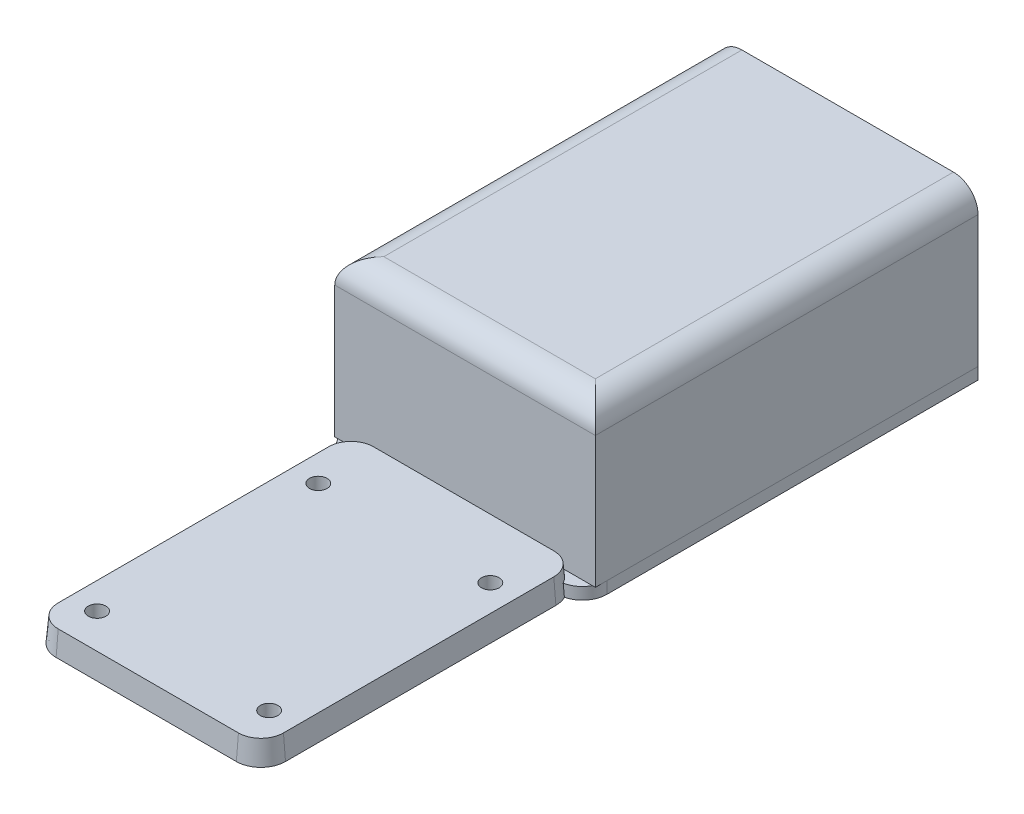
SolidWorks part; units mm, degrees
ref_plane "Front Plane" through (0, 0, 0) normal (0, 0, 1) x (1, 0, 0)
ref_plane "Top Plane" through (0, 0, 0) normal (0, 1, 0) x (1, 0, 0)
ref_plane "Right Plane" through (0, 0, 0) normal (1, 0, 0) x (0, 0, -1)
sketch "Sketch1" plane through (0, 0, 0) normal (0, 1, 0) x (1, 0, 0)
  line L1 (22, -39) -> (-22, -39)
  line L2 (28, -33) -> (28, 33)
  line L3 (22, 39) -> (-22, 39)
  line L4 (-28, -33) -> (-28, 33)
  line L5 (28, -39) -> (-28, 39) construction
  line L6 (28, 39) -> (-28, -39) construction
  arc A0 (-28, -33) -> (-22, -39) centre (-22, -33) ccw
  arc A1 (22, -39) -> (28, -33) centre (22, -33) ccw
  arc A2 (28, 33) -> (22, 39) centre (22, 33) ccw
  arc A3 (-22, 39) -> (-28, 33) centre (-22, 33) ccw
  point P0 (0, 0)
  dimension "D3" = 6
  dimension "D1" = 56
  dimension "D2" = 78
extrude "Boss-Extrude1" add sketch "Sketch1" along normal blind 5.8 draft 5
hole_wizard "Ø4.3 (4.3) Diameter Hole1" positions "Sketch4" profile "Sketch3" hole size "Ø4.3" standard "ANSI Metric"
sketch "Sketch4" plane through (0, 5.8, 0) normal (0, 1, 0) x (1, 0, 0)
  line L0 (0, 0) -> (0, -3) construction
  line L3 (21, -30) -> (-21, -30)
  line L4 (21, -30) -> (21, 24)
  line L5 (21, 24) -> (-21, 24)
  line L6 (-21, -30) -> (-21, 24)
  line L7 (21, -30) -> (-21, 24) construction
  line L8 (21, 24) -> (-21, -30) construction
  point P7 (-21, 24)
  point P208 (21, -30)
  point P209 (21, 24)
  point P210 (-21, -30)
  dimension "D1" = 3
  dimension "D2" = 42
  dimension "D3" = 54
sketch "Sketch3" plane through (-21, 5.8, -24) normal (1, 0, 0) x (0, 0, 1)
  line L0 (0, 0) -> (0, 5.8)
  line L1 (0, 5.8) -> (2.15, 5.8)
  line L2 (2.15, 5.8) -> (2.15, 0)
  line L5 (2.15, 0) -> (0, 0)
  line L11 (0, -6.35) -> (0, 107.95) construction
  dimension "Thru Hole Dia." = 4.3
  dimension "Thru Hole Depth" = 5.8
sketch "Sketch6" plane through (0, 0, 0) normal (0, -1, 0) x (-1, 0, 0)
  line L0 (31.6747, 41.5876) -> (31.6747, 132.1554)
  line L1 (25.6747, 35.5876) -> (-25.8878, 35.5876)
  line L2 (31.6747, 132.1554) -> (-31.8878, 132.1554)
  line L3 (-31.8878, 41.5876) -> (-31.8878, 132.1554)
  line L4 (31.6747, 35.5876) -> (-31.8878, 132.1554) construction
  line L5 (31.6747, 132.1554) -> (-31.8878, 35.5876) construction
  arc A0 (-31.8878, 41.5876) -> (-25.8878, 35.5876) centre (-25.8878, 41.5876) ccw
  arc A1 (31.6747, 41.5876) -> (25.6747, 35.5876) centre (25.6747, 41.5876) cw
  point P1 (-0.1065, 83.8715)
  dimension "D3" = 6
  dimension "D1" = 63.5625
  dimension "D2" = 96.5679
extrude "Boss-Extrude2" add sketch "Sketch6" against normal blind 2.9
hole_wizard "Ø4.3 (4.3) Diameter Hole2" positions "3DSketch1" profile "Sketch8" hole size "Ø4.3" standard "ANSI Metric"
sketch3d "3DSketch1"
  line L0 (-21, 0, -24) -> (-21, 5.8, -24) construction
  line L1 (21, 0, -24) -> (21, 5.8, -24) construction
  line L2 (21, 0, 30) -> (21, 5.8, 30) construction
  line L3 (-21, 0, 30) -> (-21, 5.8, 30) construction
  point P0 (-21, 5.8, -24)
  point P5 (-21, 5.8, -24)
  point P7 (21, 5.8, -24)
  point P11 (21, 5.8, 30)
  point P15 (-21, 5.8, 30)
sketch "Sketch8" plane through (-21, 5.8, -24) normal (1, 0, 0) x (0, 0, 1)
  line L0 (0, 0) -> (0, 5.8)
  line L1 (0, 5.8) -> (2.15, 5.8)
  line L2 (2.15, 5.8) -> (2.15, 0)
  line L5 (2.15, 0) -> (0, 0)
  line L11 (0, -6.35) -> (0, 107.95) construction
  dimension "Thru Hole Dia." = 4.3
  dimension "Thru Hole Depth" = 5.8
sketch "Sketch18" plane through (0, 2.9, 0) normal (0, 1, 0) x (1, 0, 0)
  line L1 (31.8956, 38.7463) -> (-31.7287, 38.7463)
  line L2 (31.8956, 38.7463) -> (31.8956, 132.15)
  line L3 (31.8956, 132.15) -> (-31.7287, 132.15)
  line L4 (-31.7287, 38.7463) -> (-31.7287, 132.15)
extrude "Boss-Extrude4" add sketch "Sketch18" along normal blind 38.1
sketch "Sketch19" plane through (0, 0, -132.15) normal (0, 0, -1) x (-1, 0, 0)
  line L1 (29.0185, 33.8964) -> (-29.4015, 33.8964)
  line L2 (29.0185, 33.8964) -> (29.0185, 8.4964)
  line L3 (29.0185, 8.4964) -> (-29.4015, 8.4964)
  line L4 (-29.4015, 33.8964) -> (-29.4015, 8.4964)
  line L5 (29.0185, 33.8964) -> (-29.4015, 8.4964) construction
  line L6 (29.0185, 8.4964) -> (-29.4015, 33.8964) construction
  point P0 (-0.1915, 21.1964)
  dimension "D1" = 25.4
  dimension "D2" = 58.42
extrude "Cut-Extrude1" cut sketch "Sketch19" against normal blind 88.9
hole_wizard "Ø2.5mm Dowel Hole3" positions "Sketch40" profile "Sketch41" hole size "Ø2.5" standard "ANSI Metric"
sketch "Sketch40" plane through (0, 0, -132.15) normal (0, 0, -1) x (-1, 0, 0)
  point P0 (0, 37.3145)
  point P2 (0, 5.0409)
  point P3 (0, 0)
sketch "Sketch41" plane through (0, 37.3145, -132.15) normal (1, 0, 0) x (0, 1, 0)
  line L0 (0, 0) -> (0, 13.4511)
  line L1 (0, 13.4511) -> (1.25, 12.7)
  line L2 (1.25, 12.7) -> (1.25, 0)
  line L5 (1.25, 0) -> (0, 0)
  line L10 (0, 13.4511) -> (-1.25, 12.7) construction
  line L11 (0, -6.35) -> (0, 107.95) construction
  dimension "Hole Dia." = 2.5
  dimension "Hole Depth" = 12.7
  dimension "Drill Angle" = 118
fillet "Fillet1" radius 5.9944 3 edges at (-31.7287, 41, -85.4481) (0.0834, 41, -38.7463) (31.8956, 41, -85.4481)
